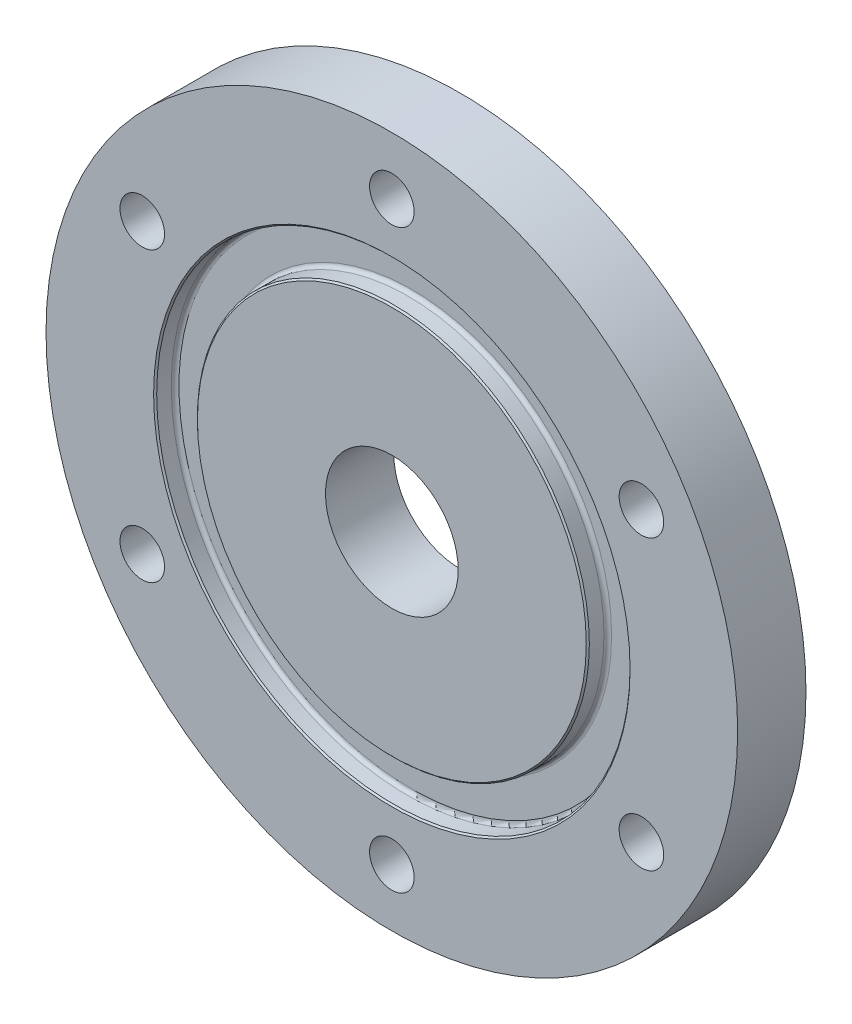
SolidWorks part; units mm, degrees
ref_plane "Front Plane" through (0, 0, 0) normal (0, 0, 1) x (1, 0, 0)
ref_plane "Top Plane" through (0, 0, 0) normal (0, 1, 0) x (1, 0, 0)
ref_plane "Right Plane" through (0, 0, 0) normal (1, 0, 0) x (0, 0, -1)
sketch "Sketch1" plane through (0, 0, 0) normal (0, 0, 1) x (1, 0, 0)
  circle A1 centre (0, 0) radius 45
  dimension "D2" = 90
extrude "Boss-Extrude1" add sketch "Sketch1" along normal blind 8.89
sketch "Sketch2" plane through (0, 0, 8.89) normal (0, 0, 1) x (1, 0, 0)
  circle A2 centre (0, 0) radius 25.5
  circle A3 centre (0, 0) radius 30.8
  dimension "D1" = 51
  dimension "D2" = 5.3
extrude "Cut-Extrude1" cut sketch "Sketch2" against normal blind 2.6 contours A3 A2
sketch "Sketch4" plane through (0, 0, 8.89) normal (0, 0, 1) x (1, 0, 0)
  circle A0 centre (0, 0) radius 37.5
  point P2 (0, 37.5)
  dimension "D1" = 75
hole_wizard "M5 Clearance Hole1" positions "Sketch4" profile "Sketch5" hole size "M5" standard "ANSI Metric"
sketch "Sketch5" plane through (0, 37.5, 8.89) normal (1, 0, 0) x (0, -1, 0)
  line L0 (0, 0) -> (0, 8.89)
  line L1 (0, 8.89) -> (2.9, 8.89)
  line L2 (2.9, 8.89) -> (2.9, 0)
  line L5 (2.9, 0) -> (0, 0)
  line L11 (0, -6.35) -> (0, 107.95) construction
  dimension "Thru Hole Dia." = 5.8
  dimension "Thru Hole Depth" = 8.89
pattern_circular "CirPattern1" count 6 every 60 about axis through (0, 0, 0) along (0, 0, 1) of "M5 Clearance Hole1"
fillet "Fillet1" radius 0.5 2 edges at (25.5, 0, 6.29) (30.8, 0, 6.29)
chamfer "Chamfer1" distance 0.2 angle 45 2 edges at (25.5, 0, 8.89) (30.8, 0, 8.89)
sketch "Sketch6" plane through (0, 0, 0) normal (0, 0, -1) x (-1, 0, 0)
  circle A0 centre (0, 0) radius 8.636
  circle A1 centre (0, 0) radius 45
  circle A2 centre (0, 0) radius 45
  dimension "D2" = 17.272
  dimension "D1" = 0
extrude "Cut-Extrude2" cut sketch "Sketch6" against normal up to next contours A0
